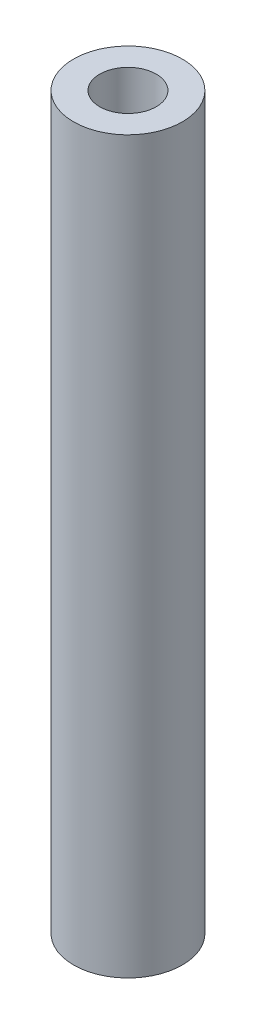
SolidWorks part; units mm, degrees
ref_plane "Front Plane" through (0, 0, 0) normal (0, 0, 1) x (1, 0, 0)
ref_plane "Top Plane" through (0, 0, 0) normal (0, 1, 0) x (1, 0, 0)
ref_plane "Right Plane" through (0, 0, 0) normal (1, 0, 0) x (0, 0, -1)
sketch "Sketch1" plane through (0, 0, 0) normal (0, 1, 0) x (1, 0, 0)
  circle A0 centre (0, 0) radius 6.35
  circle A1 centre (0, 0) radius 3.302
  dimension "D1" = 12.7
  dimension "D2" = 6.604
extrude "Boss-Extrude1" add sketch "Sketch1" along normal blind 85.217
